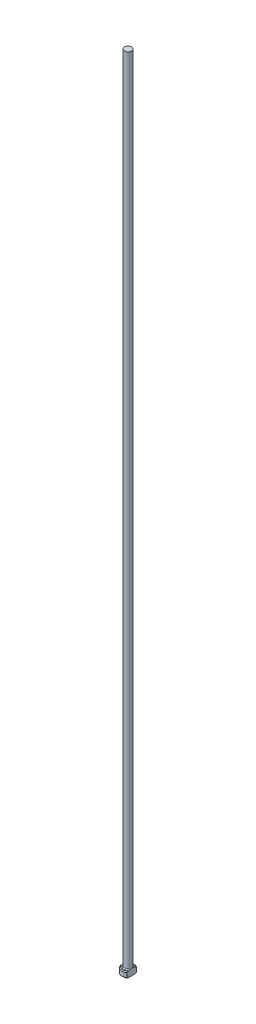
SolidWorks part; units mm, degrees
ref_plane "Front Plane" through (0, 0, 0) normal (0, 0, 1) x (1, 0, 0)
ref_plane "Top Plane" through (0, 0, 0) normal (0, 1, 0) x (1, 0, 0)
ref_plane "Right Plane" through (0, 0, 0) normal (1, 0, 0) x (0, 0, -1)
sketch "Sketch1" plane through (0, 0, 0) normal (0, 0, 1) x (1, 0, 0)
  line L0 (0, 259.9588) -> (0, -15.1925) construction
  line L1 (0, 0) -> (-1.5, 0)
  line L2 (-1.5, 0) -> (-1.5, 1.5)
  line L3 (-1.5, 1.5) -> (-0.9, 1.5)
  line L4 (-0.9, 1.5) -> (-0.9, 200)
  line L5 (-0.9, 200) -> (0, 200)
  line L6 (0, 200) -> (0, 0)
  dimension "L" = 200
  dimension "H" = 3
  dimension "T" = 1.5
  dimension "D" = 1.8
revolve "Revolve1" add sketch "Sketch1" angle 360 about L0
chamfer "Chamfer1" distance 0.2 angle 45 2 edges at (0, 1.5, 1.5) (0, 0, 1.5)
fillet "Fillet1" radius 0.2 1 edges at (0, 1.5, 0.9)
sketch "Sketch2" plane through (0, 0, 0) normal (0, 1, 0) x (1, 0, 0)
  line L0 (0.9, 1.2) -> (0.9, -1.2)
  circle A0 centre (0, 0) radius 1.5 construction
  arc A1 (0.9, -1.2) -> (0.9, 1.2) centre (0, 0) ccw
  circle A2 centre (0, 0) radius 0.9 construction
extrude "KEY" cut sketch "Sketch2" along normal through all
